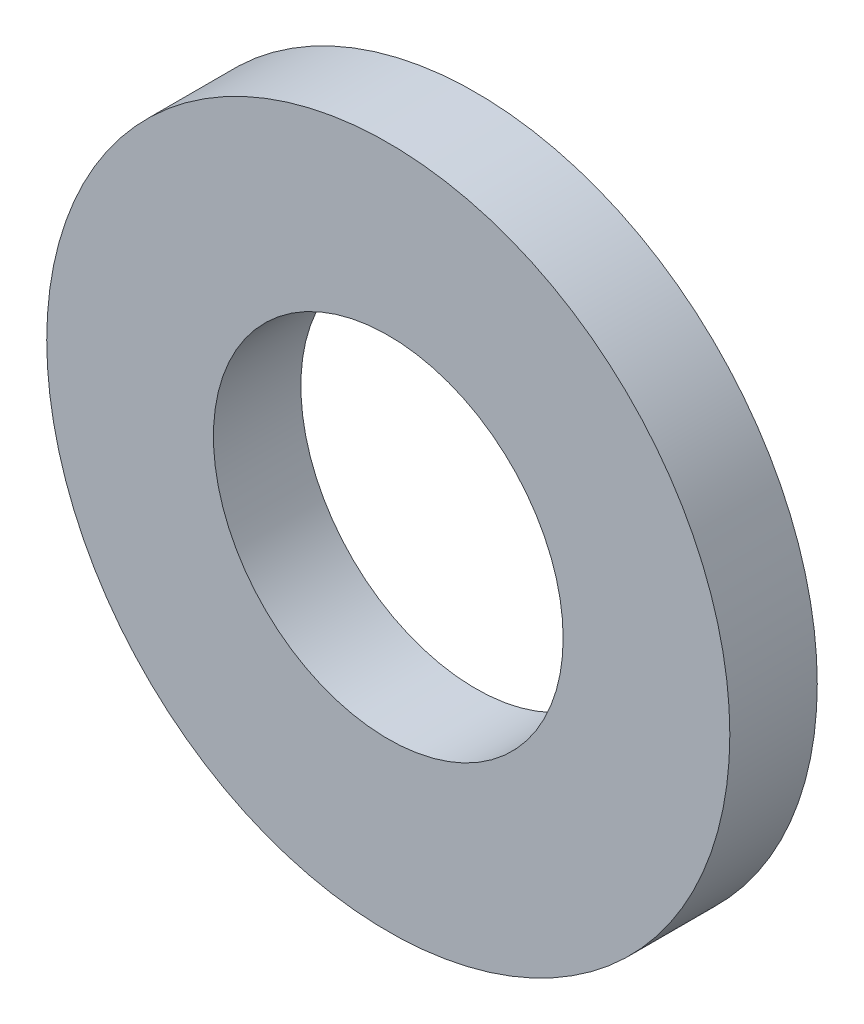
SolidWorks part; units mm, degrees
ref_plane "Front" through (0, 0, 0) normal (0, 0, 1) x (1, 0, 0)
ref_plane "Top" through (0, 0, 0) normal (0, 1, 0) x (1, 0, 0)
ref_plane "Right" through (0, 0, 0) normal (1, 0, 0) x (0, 0, -1)
sketch "Sketch1" plane through (0, 0, 0) normal (0, 0, 1) x (1, 0, 0)
  circle A0 centre (0, 0) radius 6.25
  circle A1 centre (0, 0) radius 3.2
  dimension "d1" = 6.4
  dimension "d2" = 12.5
extrude "Base-Extrude" add sketch "Sketch1" along normal blind 1.6
